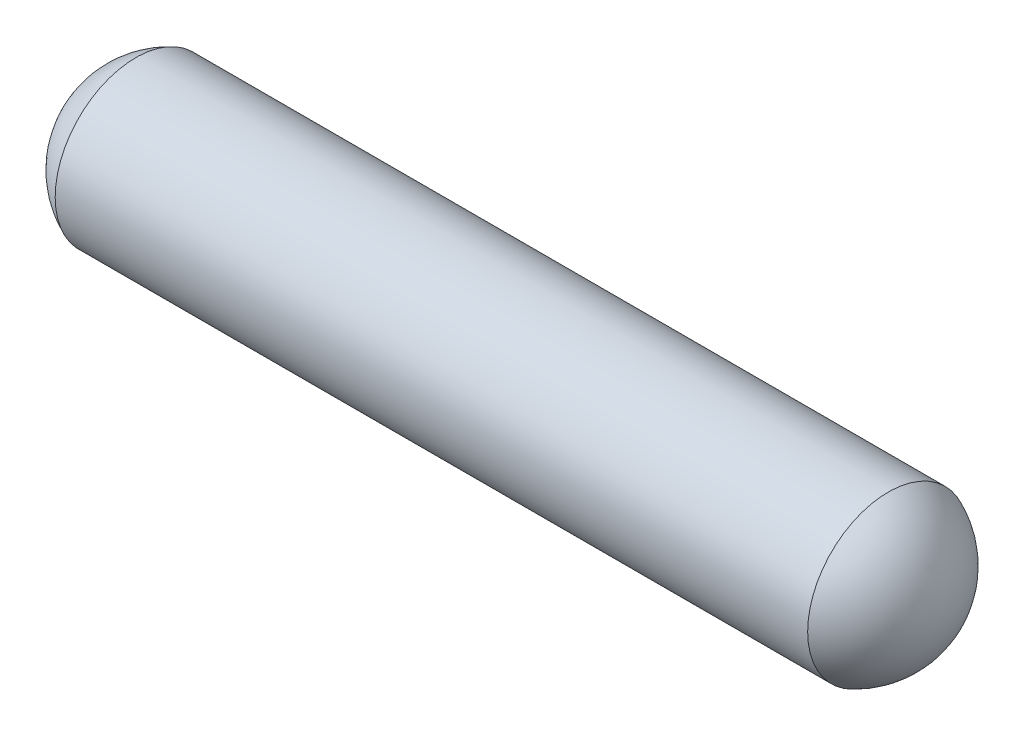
SolidWorks part; units mm, degrees
ref_plane "Plan1" through (0, 0, 0) normal (0, 0, 1) x (1, 0, 0)
ref_plane "Plan2" through (0, 0, 0) normal (0, 1, 0) x (1, 0, 0)
ref_plane "Plan3" through (0, 0, 0) normal (1, 0, 0) x (0, 0, -1)
sketch "Esquisse1" plane through (0, 0, 0) normal (0, 1, 0) x (1, 0, 0)
  line L1 (-3.5, 0) -> (3.5, 0)
  line L5 (-3.5, 0) -> (-3.5, 0.75)
  line L6 (-3.5, 0.75) -> (3.5, 0.75)
  line L7 (3.5, 0.75) -> (3.5, 0)
  line L8 (-3.5, 0) -> (3.5, 0) construction
  dimension "D1" = 0.75
  dimension "D2" = 7
  dimension "D3" = 3.5
revolve "Base-Révolution" add sketch "Esquisse1" angle 360 about L8
dome "Dôme1" faces to dome 1 distance 0.5 parameters "D1"=0.5
dome "Dôme2" faces to dome 1 distance 0.5 parameters "D1"=0.5
